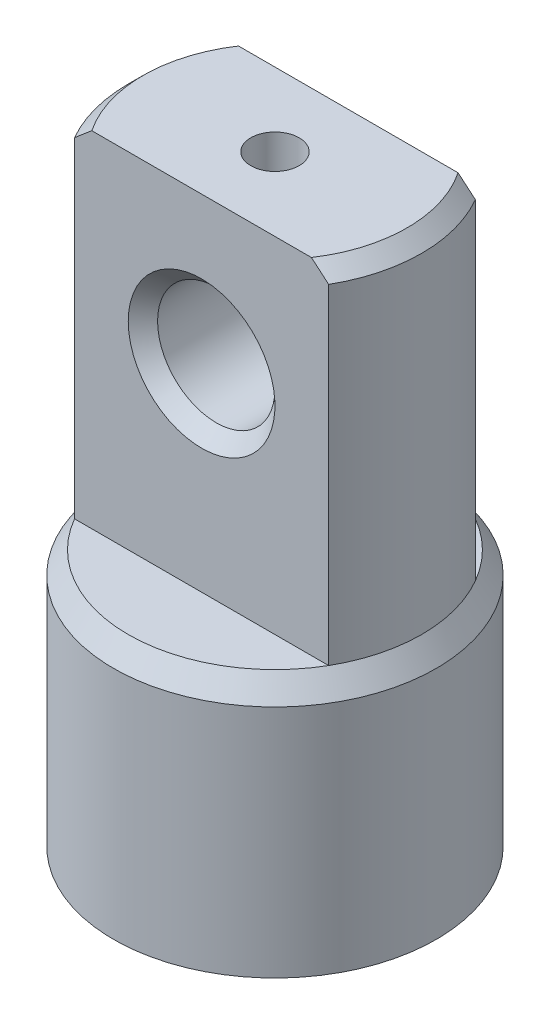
SolidWorks part; units mm, degrees
ref_plane "Front Plane" through (0, 0, 0) normal (0, 0, 1) x (1, 0, 0)
ref_plane "Top Plane" through (0, 0, 0) normal (0, 1, 0) x (1, 0, 0)
ref_plane "Right Plane" through (0, 0, 0) normal (1, 0, 0) x (0, 0, -1)
sketch "Sketch1" plane through (0, 0, 0) normal (0, 0, 1) x (1, 0, 0)
  line L0 (0, 0) -> (11, 0)
  line L1 (11, 0) -> (11, 16)
  line L4 (10, 17.5) -> (10, 41)
  line L5 (10, 41) -> (0, 41)
  line L6 (0, 0) -> (0, 41) construction
  line L7 (0, 0) -> (0, 41)
  line L8 (10, 17.5) -> (11, 16)
  dimension "D1" = 22
  dimension "D2" = 25
  dimension "D3" = 20
  dimension "D4" = 16
  dimension "D5" = 23.5
revolve "Revolve1" add sketch "Sketch1" angle 360 about L6
sketch "Sketch2" plane through (0, 41, 0) normal (0, 1, 0) x (1, 0, 0)
  line L1 (5.7735, 0) -> (2.8868, 5)
  line L2 (2.8868, 5) -> (-2.8868, 5)
  line L3 (-2.8868, 5) -> (-5.7735, 0)
  line L4 (-5.7735, 0) -> (-2.8868, -5)
  line L5 (-2.8868, -5) -> (2.8868, -5)
  line L6 (2.8868, -5) -> (5.7735, 0)
  circle A0 centre (0, 0) radius 5 construction
  dimension "D1" = 10
extrude "Cut-Extrude2" [suppressed] cut sketch "Sketch2" against normal blind 8
sketch "Sketch3" plane through (0, 41, 0) normal (0, 1, 0) x (-1, 0, 0)
  line L0 (0, 5) -> (0, -5) construction
  line L1 (9.798, -5) -> (-9.798, -5)
  line L3 (9.798, 5) -> (-9.798, 5)
  circle A0 centre (0, 0) radius 11 construction
  arc A1 (9.798, 5) -> (-9.798, 5) centre (0, 0) ccw
  arc A2 (-9.798, -5) -> (9.798, -5) centre (0, 0) ccw
  dimension "D2" = 10
extrude "Cut-Extrude3" cut sketch "Sketch3" against normal blind 23.5
chamfer "Chamfer1" distance 1 angle 45 2 edges at (10, 41, 0) (-10, 41, 0)
hole_wizard "Ø8.0 (8) Diameter Hole1" positions "Sketch5" profile "Sketch4" hole size "Ø8.0" standard "ISO"
sketch "Sketch5" plane through (0, 0, 5) normal (0, 0, 1) x (1, 0, 0)
  line L0 (7.4833, 41) -> (-7.4833, 41) construction
  point P0 (0, 31)
  dimension "D1" = 10
sketch "Sketch4" plane through (0, 31, 5) normal (1, 0, 0) x (0, -1, 0)
  line L0 (0, 0) -> (0, 10)
  line L1 (0, 10) -> (4, 10)
  line L2 (4, 10) -> (4, 0)
  line L5 (4, 0) -> (0, 0)
  line L11 (0, -6.35) -> (0, 107.95) construction
  dimension "Thru Hole Dia." = 8
  dimension "Thru Hole Depth" = 10
chamfer "Chamfer2" distance 1 angle 45 2 edges at (4, 31, -5) (4, 31, 5)
hole_wizard "M4 Tapped Hole1" positions "Sketch7" profile "Sketch6" tap size "M4" standard "ISO"
sketch "Sketch7" plane through (0, 41, 0) normal (0, 1, 0) x (-1, 0, 0)
  point P0 (0, 0)
sketch "Sketch6" plane through (0, 41, 0) normal (1, 0, 0) x (0, 0, 1)
  line L0 (0, 0) -> (0, 6)
  line L1 (0, 6) -> (1.65, 6)
  line L2 (1.65, 6) -> (1.65, 0)
  line L5 (1.65, 0) -> (0, 0)
  line L11 (0, -6.35) -> (0, 107.95) construction
  dimension "Thru Tap Drill Dia." = 3.3
  dimension "Thru Tap Drill Depth" = 6
